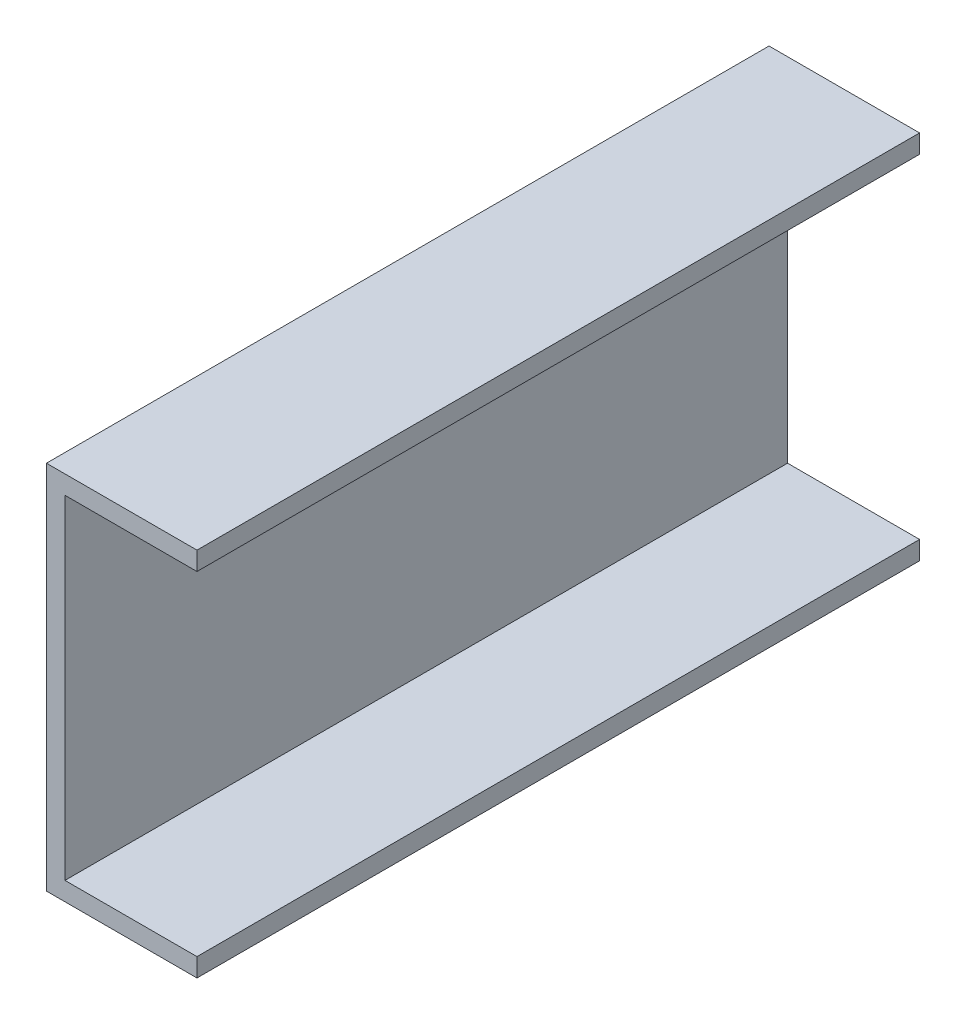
SolidWorks part; units mm, degrees
ref_plane "Front Plane" through (0, 0, 0) normal (0, 0, 1) x (1, 0, 0)
ref_plane "Top Plane" through (0, 0, 0) normal (0, 1, 0) x (1, 0, 0)
ref_plane "Right Plane" through (0, 0, 0) normal (1, 0, 0) x (0, 0, -1)
sketch "Sketch1" plane through (0, 0, 0) normal (0, 0, 1) x (1, 0, 0)
  line L0 (65, 0) -> (0, 0)
  line L1 (0, 0) -> (0, 160)
  line L2 (0, 160) -> (65, 160)
  line L3 (65, 160) -> (65, 152)
  line L4 (65, 152) -> (8, 152)
  line L5 (8, 152) -> (8, 8)
  line L6 (8, 8) -> (65, 8)
  line L7 (65, 8) -> (65, 0)
  dimension "D1" = 160
  dimension "D2" = 65
  dimension "D3" = 8
  dimension "D4" = 8
extrude "Boss-Extrude1" add sketch "Sketch1" along normal blind 312
